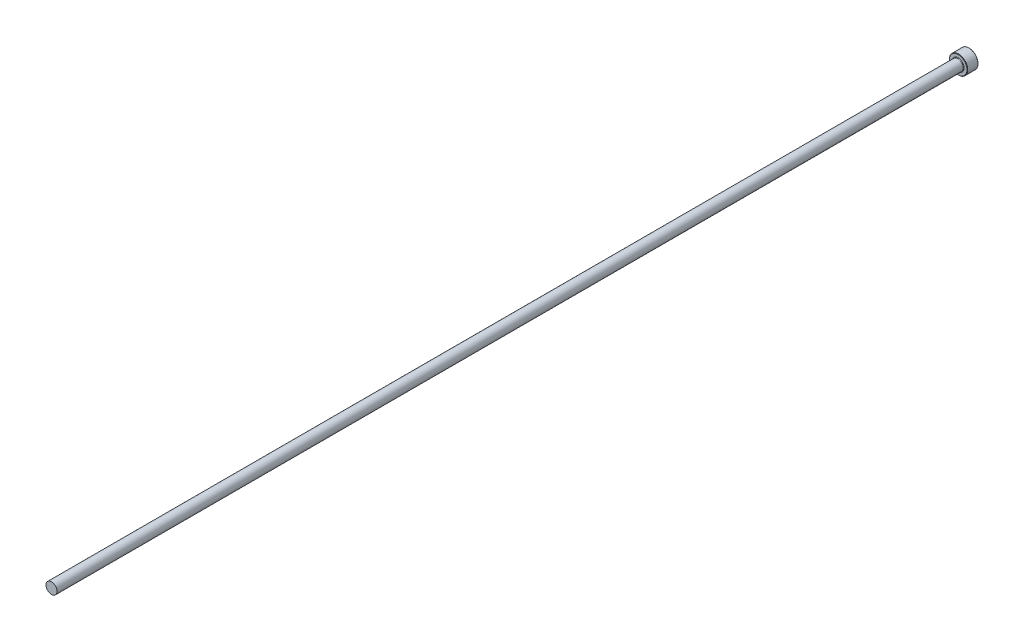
SolidWorks part; units mm, degrees
ref_plane "Front Plane" through (0, 0, 0) normal (0, 0, 1) x (1, 0, 0)
ref_plane "Top Plane" through (0, 0, 0) normal (0, 1, 0) x (1, 0, 0)
ref_plane "Right Plane" through (0, 0, 0) normal (1, 0, 0) x (0, 0, -1)
sketch "Sketch1" plane through (0, 0, 0) normal (1, 0, 0) x (0, 0, -1)
  line L0 (0, 0) -> (0, 5)
  line L1 (0, 5.5) -> (0, -5.5) construction
  line L2 (0, 5) -> (-6, 5)
  line L3 (-6, 5) -> (-6, 3.3)
  line L4 (-6.3, 3) -> (-500, 3)
  line L5 (-500, 3) -> (-500, 0)
  line L6 (5.5, 0) -> (-5.5, 0) construction
  line L7 (-500, 0) -> (0, 0)
  line L8 (-109.0506, 0) -> (16.9928, 0) construction
  arc A0 (-6, 3.3) -> (-6.3, 3) centre (-6.3, 3.3) cw
  dimension "D1" = 0.3
  dimension "D2" = 10
  dimension "D3" = 6
  dimension "D4" = 500
  dimension "D5" = 6
revolve "Revolve1" add sketch "Sketch1" angle 360 about L8
chamfer "Chamfer1" distance 0.2 angle 45 2 edges at (5, 0, 0) (5, 0, 6)
